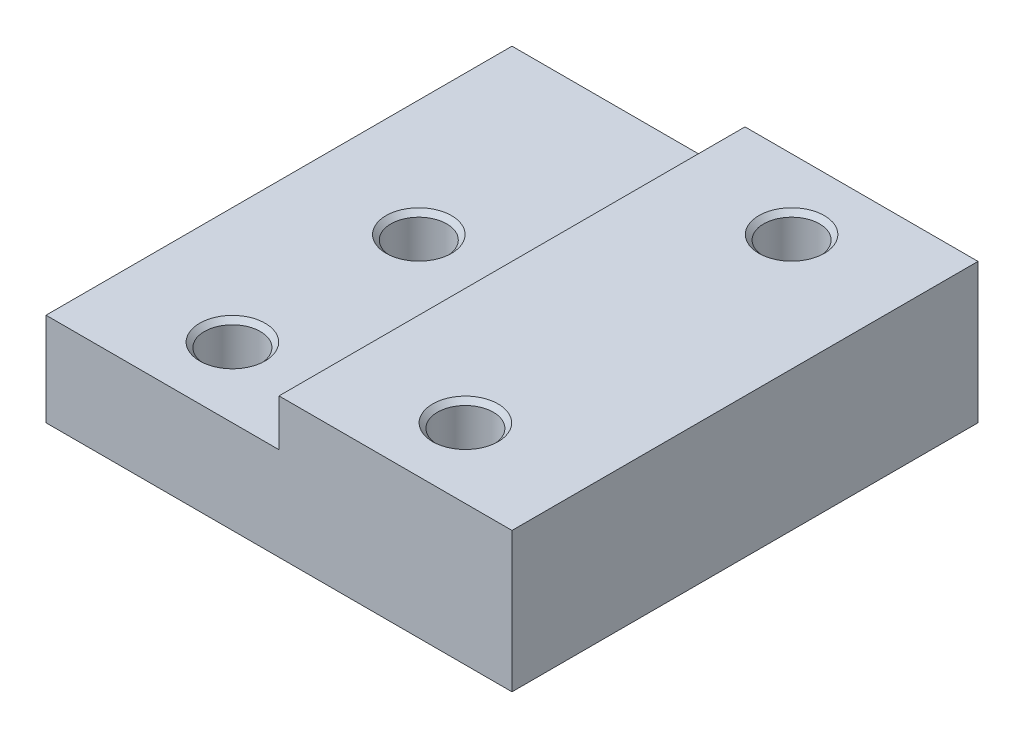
SolidWorks part; units mm, degrees
ref_plane "Ebene vorne" through (0, 0, 0) normal (0, 0, 1) x (1, 0, 0)
ref_plane "Ebene oben" through (0, 0, 0) normal (0, 1, 0) x (1, 0, 0)
ref_plane "Ebene rechts" through (0, 0, 0) normal (1, 0, 0) x (0, 0, -1)
sketch "Skizze2" plane through (0, 0, 0) normal (0, 0, 1) x (1, 0, 0)
  line L0 (0, 0) -> (100, 0)
  line L1 (100, 0) -> (100, 30)
  line L2 (100, 30) -> (50, 30)
  line L3 (50, 30) -> (50, 20)
  line L4 (50, 20) -> (0, 20)
  line L5 (0, 20) -> (0, 0)
  dimension "D1" = 100
  dimension "D2" = 30
  dimension "D3" = 10
  dimension "D4" = 50
extrude "Aufsatz-Linear austragen1" add sketch "Skizze2" along normal blind 100
hole_wizard "M14 Gewindebohrung1" positions "Skizze6" profile "Skizze5" tap size "M14" standard "DIN"
sketch "Skizze6" plane through (0, 30, 0) normal (0, 1, 0) x (-1, 0, 0)
  line L0 (-100, 100) -> (-50, 100) construction
  line L1 (-100, 0) -> (-50, 0) construction
  line L2 (-100, 100) -> (-100, 0) construction
  point P0 (-75, 15)
  point P1 (-75, 85)
  dimension "D1" = 15
  dimension "D2" = 15
  dimension "D3" = 25
  dimension "D4" = 25
sketch "Skizze5" plane through (75, 30, 15) normal (1, 0, 0) x (0, 0, 1)
  line L0 (0, 0) -> (0, 23.6052)
  line L1 (0, 23.6052) -> (6, 20)
  line L2 (6, 20) -> (6, 1.025)
  line L3 (6, 1.025) -> (7.025, 0)
  line L5 (7.025, 0) -> (0, 0)
  line L6 (-6, 1.025) -> (-7.025, 0) construction
  line L10 (0, 23.6052) -> (-6, 20) construction
  line L11 (0, -6.35) -> (0, 107.95) construction
  dimension "Bohrerdurchmesser" = 12
  dimension "Bohrungstiefe" = 20
  dimension "Senkdurchmesser (Oben)" = 14.05
  dimension "Senkwinkel (Oben)" = 90
  dimension "Spitzenwinkel" = 118
hole_wizard "M14 Gewindebohrung2" positions "Skizze10" profile "Skizze9" tap size "M14" standard "DIN"
sketch "Skizze10" plane through (0, 20, 0) normal (0, 1, 0) x (-1, 0, 0)
  line L0 (0, 100) -> (0, 0) construction
  line L1 (-50, 0) -> (0, 0) construction
  point P0 (-25, 85)
  point P1 (-25, 45)
  dimension "D1" = 25
  dimension "D2" = 25
  dimension "D3" = 45
  dimension "D4" = 40
sketch "Skizze9" plane through (25, 20, 85) normal (1, 0, 0) x (0, 0, 1)
  line L0 (0, 0) -> (0, 20)
  line L1 (0, 20) -> (6, 20)
  line L2 (6, 20) -> (6, 1.025)
  line L3 (6, 1.025) -> (7.025, 0)
  line L5 (7.025, 0) -> (0, 0)
  line L6 (-6, 1.025) -> (-7.025, 0) construction
  line L11 (0, -6.35) -> (0, 107.95) construction
  dimension "Bohrerdurchmesser" = 12
  dimension "Bohrungstiefe" = 20
  dimension "Senkdurchmesser (Oben)" = 14.05
  dimension "Senkwinkel (Oben)" = 90
